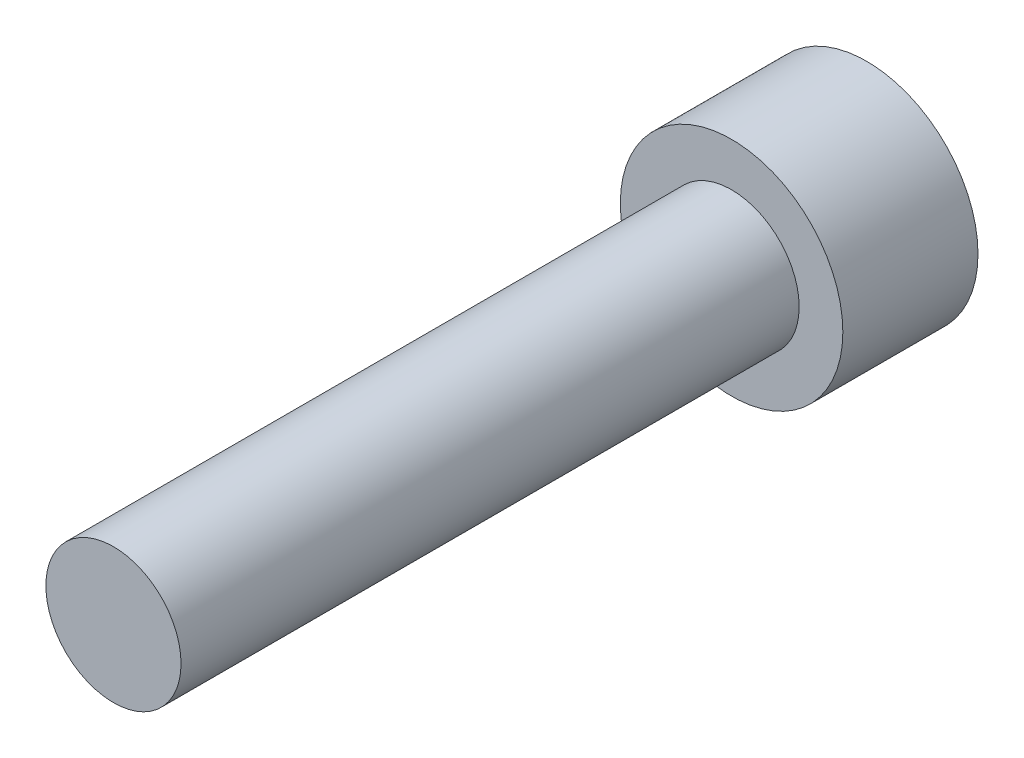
SolidWorks part; units mm, degrees
ref_plane "Front Plane" through (0, 0, 0) normal (0, 0, 1) x (1, 0, 0)
ref_plane "Top Plane" through (0, 0, 0) normal (0, 1, 0) x (1, 0, 0)
ref_plane "Right Plane" through (0, 0, 0) normal (1, 0, 0) x (0, 0, -1)
sketch "Sketch6" plane through (0, 0, 0) normal (1, 0, 0) x (0, 0, -1)
  line L0 (-19.05, 0) -> (22.525, 0) construction
  line L1 (3.7719, 0) -> (-3.7719, 0) construction
  line L2 (-19.05, 0) -> (-19.05, -2.0828)
  line L3 (-19.05, -2.0828) -> (0, -2.0828)
  line L4 (0, 3.7719) -> (0, -3.7719) construction
  line L5 (0, -2.0828) -> (0, -3.429)
  line L6 (0, -3.429) -> (4.1656, -3.429)
  line L7 (4.1656, -3.429) -> (4.1656, 0)
  line L8 (4.1656, 0) -> (-19.05, 0)
  dimension "L" = 19.05
  dimension "H" = 4.1656
  dimension "A" = 6.858
  dimension "D" = 4.1656
revolve "Revolve1" add sketch "Sketch6" angle 360 about L0
sketch "Sketch7" plane through (0, 0, -4.1656) normal (0, 0, -1) x (-1, 0, 0)
  line L2 (-1.778, 1.0265) -> (-1.778, -1.0265)
  line L4 (-1.778, -1.0265) -> (0, -2.0531)
  line L5 (0, -2.0531) -> (1.778, -1.0265)
  line L6 (1.778, -1.0265) -> (1.778, 1.0265)
  line L7 (1.778, 1.0265) -> (0, 2.0531)
  line L8 (0, 2.0531) -> (-1.778, 1.0265)
  circle A0 centre (0, 0) radius 1.778 construction
  dimension "J" = 3.556
extrude "HEX" cut sketch "Sketch7" against normal blind 2.794
